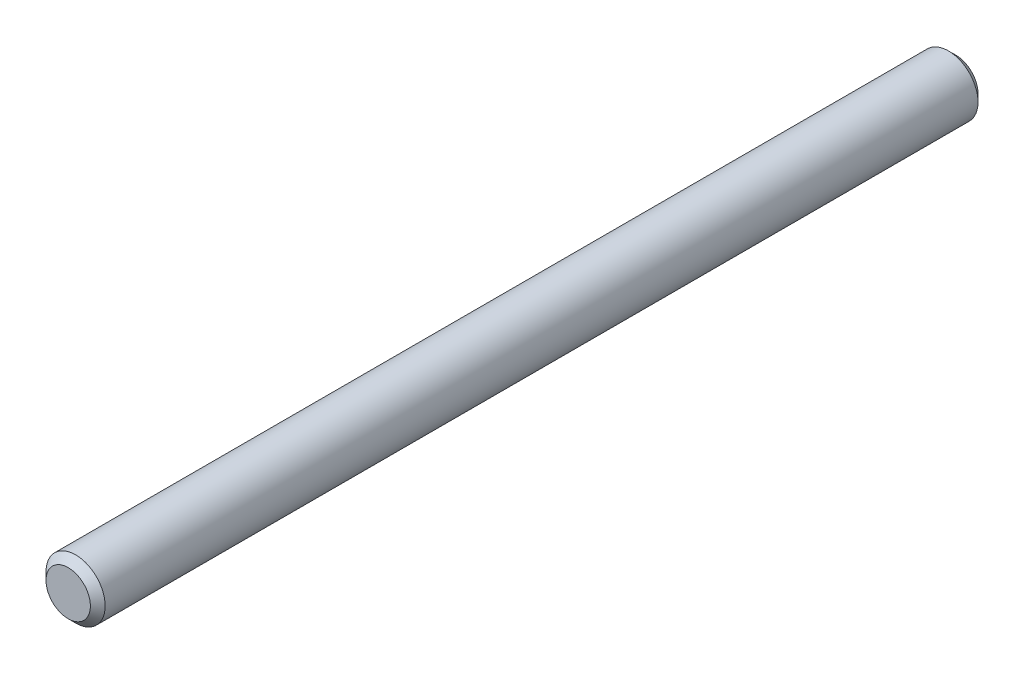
SolidWorks part; units mm, degrees
ref_plane "前视基准面" through (0, 0, 0) normal (0, 0, 1) x (1, 0, 0)
ref_plane "上视基准面" through (0, 0, 0) normal (0, 1, 0) x (1, 0, 0)
ref_plane "右视基准面" through (0, 0, 0) normal (1, 0, 0) x (0, 0, -1)
sketch "草图1" plane through (0, 0, 0) normal (0, 0, 1) x (1, 0, 0)
  circle A0 centre (0, 0) radius 2
extrude "凸台-拉伸1" add sketch "草图1" against normal blind 60
chamfer "倒角1" distance 0.5 angle 45 2 edges at (2, 0, -60) (2, 0, 0)
